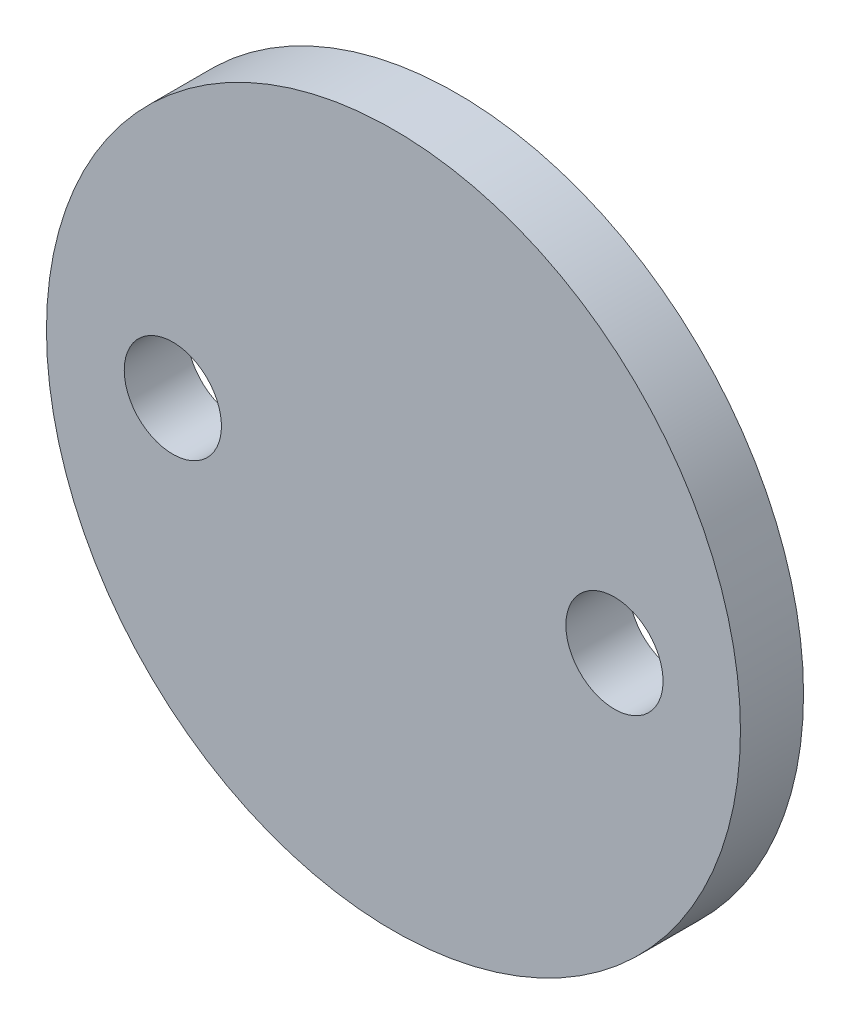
SolidWorks part; units mm, degrees
ref_plane "Front Plane" through (0, 0, 0) normal (0, 0, 1) x (1, 0, 0)
ref_plane "Top Plane" through (0, 0, 0) normal (0, 1, 0) x (1, 0, 0)
ref_plane "Right Plane" through (0, 0, 0) normal (1, 0, 0) x (0, 0, -1)
sketch "Sketch1" plane through (0, 0, 0) normal (0, 0, 1) x (1, 0, 0)
  line L1 (-21.035, 0) -> (19.0946, 0) construction
  line L2 (0, 17.4625) -> (11.7794, 17.4625) construction
  line L4 (-7.1438, 18.452) -> (-7.1437, -4.8303) construction
  circle A0 centre (0, 0) radius 17.4625
  dimension "D2" = 34.925
extrude "Extrude1" add sketch "Sketch1" along normal blind 3.175
sketch "Sketch3" plane through (0, 0, 0) normal (0, 0, -1) x (-1, 0, 0)
  circle A0 centre (-11.1218, 0.2051) radius 2.4447
  circle A1 centre (11.1032, 0.2051) radius 2.4447
  dimension "D1" = 4.8895
  dimension "D2" = 4.8895
extrude "Cut-Extrude1" cut sketch "Sketch3" against normal through all
